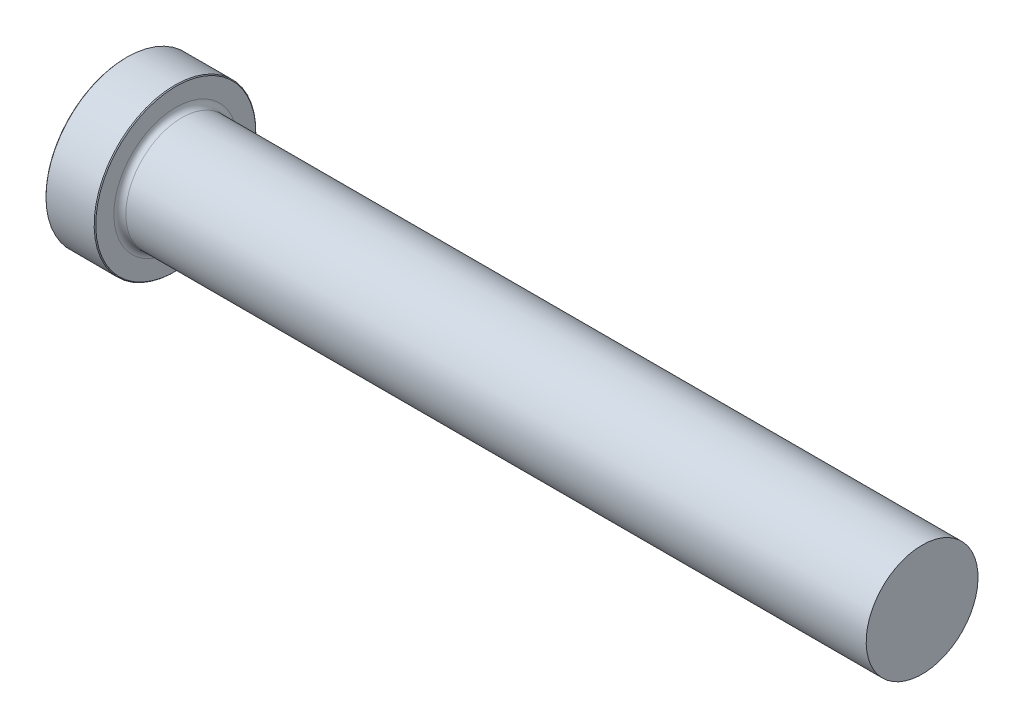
SolidWorks part; units mm, degrees
ref_plane "Front Plane" through (0, 0, 0) normal (0, 0, 1) x (1, 0, 0)
ref_plane "Top Plane" through (0, 0, 0) normal (0, 1, 0) x (1, 0, 0)
ref_plane "Right Plane" through (0, 0, 0) normal (1, 0, 0) x (0, 0, -1)
sketch "Sketch1" plane through (0, 0, 0) normal (0, 0, 1) x (1, 0, 0)
  line L0 (0, 0) -> (0, 10.3187)
  line L1 (0, 10.3187) -> (6.35, 10.3187)
  line L2 (6.35, 10.3187) -> (6.35, 7.8994)
  line L3 (7.112, 7.1374) -> (101.6, 7.1374)
  line L4 (101.6, 7.1374) -> (101.6, 0)
  line L5 (101.6, 0) -> (0, 0)
  line L6 (101.6, 0) -> (101.6, -7.1374) construction
  line L7 (101.6, -7.1374) -> (6.35, -7.1374) construction
  line L8 (0, 0) -> (0, -10.3187) construction
  line L9 (0, -10.3187) -> (6.35, -10.3187) construction
  line L10 (6.35, -10.3187) -> (6.35, -7.1374) construction
  arc A0 (6.35, 7.8994) -> (7.112, 7.1374) centre (7.112, 7.8994) ccw
  dimension "D4" = 0.762
  dimension "L" = 101.6
  dimension "D" = 14.2748
  dimension "H" = 20.6375
  dimension "T" = 6.35
revolve "Revolve1" add sketch "Sketch1" angle 360 about L5
chamfer "Chamfer1" distance 0.1016 angle 45 2 edges at (0, 10.3187, 0) (6.35, 10.3188, 0)
